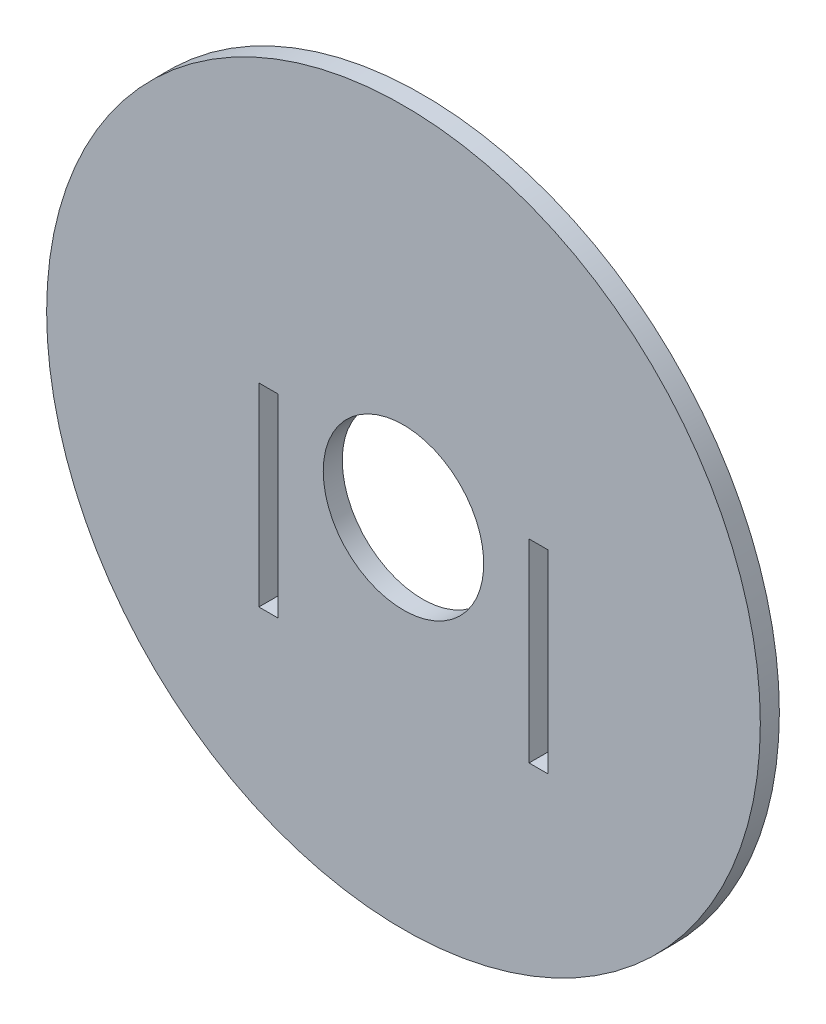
SolidWorks part; units mm, degrees
ref_plane "Front Plane" through (0, 0, 0) normal (0, 0, 1) x (1, 0, 0)
ref_plane "Top Plane" through (0, 0, 0) normal (0, 1, 0) x (1, 0, 0)
ref_plane "Right Plane" through (0, 0, 0) normal (1, 0, 0) x (0, 0, -1)
sketch "Sketch1" plane through (0, 0, 0) normal (0, 0, 1) x (1, 0, 0)
  circle A0 centre (59.4531, -177.9227) radius 6.4262
  circle A1 centre (59.4531, -177.9227) radius 28.575
  dimension "D1" = 57.15
extrude "Boss-Extrude1" add sketch "Sketch1" along normal blind 1.524
sketch "Sketch2" plane through (0, 0, 1.524) normal (0, 0, 1) x (1, 0, 0)
  line L0 (49.3984, -189.9167) -> (47.8744, -189.9167)
  line L1 (69.5077, -174.3803) -> (69.5077, -189.9167)
  line L2 (71.0317, -174.3803) -> (71.0317, -189.9167)
  line L3 (69.5077, -174.3803) -> (71.0317, -174.3803)
  line L4 (69.5077, -189.9167) -> (71.0317, -189.9167)
  line L5 (59.4531, -184.3489) -> (59.4531, -177.9227) construction
  line L6 (49.3984, -174.3803) -> (47.8744, -174.3803)
  line L7 (47.8744, -174.3803) -> (47.8744, -189.9167)
  line L8 (49.3984, -174.3803) -> (49.3984, -189.9167)
  circle A0 centre (59.4531, -177.9227) radius 6.4262 construction
extrude "Cut-Extrude1" cut sketch "Sketch2" against normal blind 2.54
